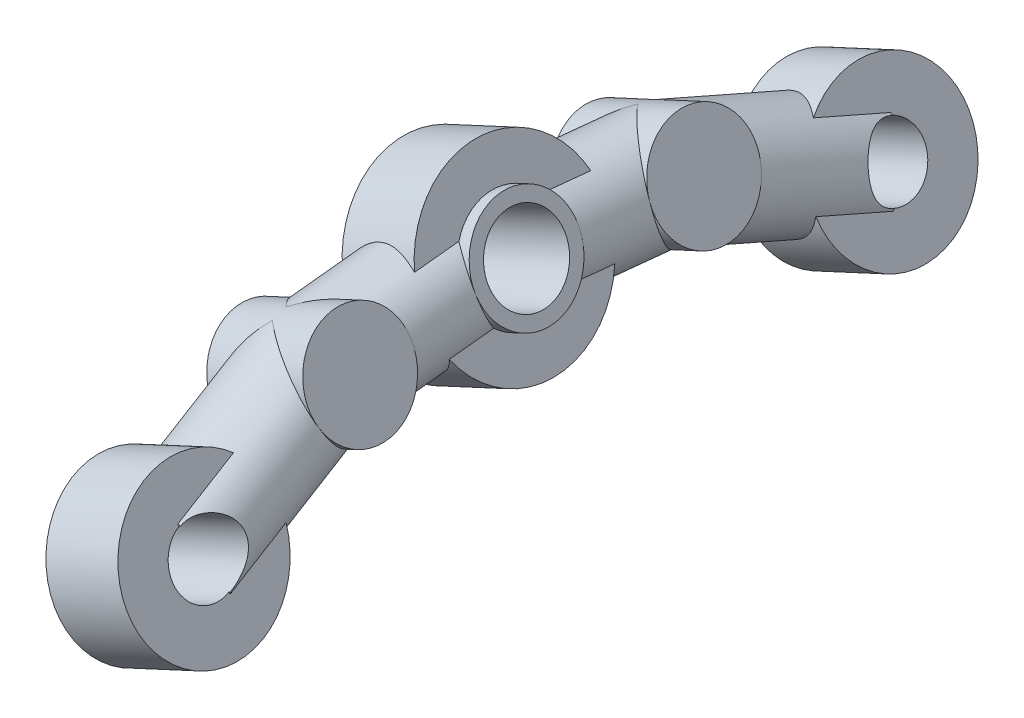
SolidWorks part; units mm, degrees
ref_plane "Alzado" through (0, 0, 0) normal (0, 0, 1) x (1, 0, 0)
ref_plane "Planta" through (0, 0, 0) normal (0, 1, 0) x (1, 0, 0)
ref_plane "Vista lateral" through (0, 0, 0) normal (1, 0, 0) x (0, 0, -1)
sketch3d "Sk_Arco_1"
  line L0 (430.9555, 383.6552, -26) -> (428.8507, 388.1906, -13)
  dimension "D1" = 13.9284
sweep "Arco_1" add path "Sk_Arco_1" parameters "D3"=8
sketch3d "Sk_Arco_2"
  line L0 (428.8507, 388.1906, -13) -> (428.4297, 389.0977, 0)
  dimension "D1" = 13.0384
sweep "Arco_2" add path "Sk_Arco_2" parameters "D3"=8
sketch3d "Sk_Arco_3"
  line L0 (428.4297, 389.0977, 0) -> (428.8507, 388.1906, 13)
  dimension "D1" = 13.0384
sweep "Arco_3" add path "Sk_Arco_3" parameters "D3"=8
sketch3d "Sk_Arco_4"
  line L0 (428.8507, 388.1906, 13) -> (430.9555, 383.6552, 26)
  dimension "D1" = 13.9284
sweep "Arco_4" add path "Sk_Arco_4" parameters "D3"=8
sketch3d "Sk_Arco_codo_1"
  line L0 (425.2224, 386.5067, -13) -> (432.479, 389.8744, -13)
  dimension "D1" = 8
sweep "Arco_codo_1" add path "Sk_Arco_codo_1" parameters "D3"=8
sketch3d "Sk_Arco_codo_2"
  line L0 (424.8014, 387.4138, 0) -> (432.058, 390.7815, 0)
  dimension "D1" = 8
sweep "Arco_codo_2" add path "Sk_Arco_codo_2" parameters "D3"=8
sketch3d "Sk_Arco_codo_3"
  line L0 (425.2224, 386.5067, 13) -> (432.479, 389.8744, 13)
  dimension "D1" = 8
sweep "Arco_codo_3" add path "Sk_Arco_codo_3" parameters "D3"=8
sketch3d "Sk_Boss_izq"
  line L0 (428.2343, 382.3923, -26) -> (433.6768, 384.9181, -26)
  dimension "D1" = 6
sweep "Boss_izq" add path "Sk_Boss_izq" parameters "D3"=12
sketch3d "Sk_Boss_dcho"
  line L0 (428.2343, 382.3923, 26) -> (433.6768, 384.9181, 26)
  dimension "D1" = 6
sweep "Boss_dcho" add path "Sk_Boss_dcho" parameters "D3"=12
sketch3d "Sk_Boss_centro"
  line L0 (425.7085, 387.8347, 0) -> (431.151, 390.3606, 0)
  dimension "D1" = 6
sweep "Boss_centro" add path "Sk_Boss_centro" parameters "D3"=14
sketch3d "Sk_Pivote_izq"
  line L0 (427.3272, 381.9713, -26) -> (434.5838, 385.3391, -26)
  dimension "D1" = 8
sweep "Pivote_izq" cut path "Sk_Pivote_izq" parameters "D3"=5
sketch3d "Sk_Pivote_dcho"
  line L0 (427.3272, 381.9713, 26) -> (434.5838, 385.3391, 26)
  dimension "D1" = 8
sweep "Pivote_dcho" cut path "Sk_Pivote_dcho" parameters "D3"=5
sketch3d "Sk_Taladro_tornillo"
  line L0 (424.8014, 387.4138, 0) -> (432.058, 390.7815, 0)
  dimension "D1" = 8
sweep "Taladro_tornillo" cut path "Sk_Taladro_tornillo" parameters "D3"=6
